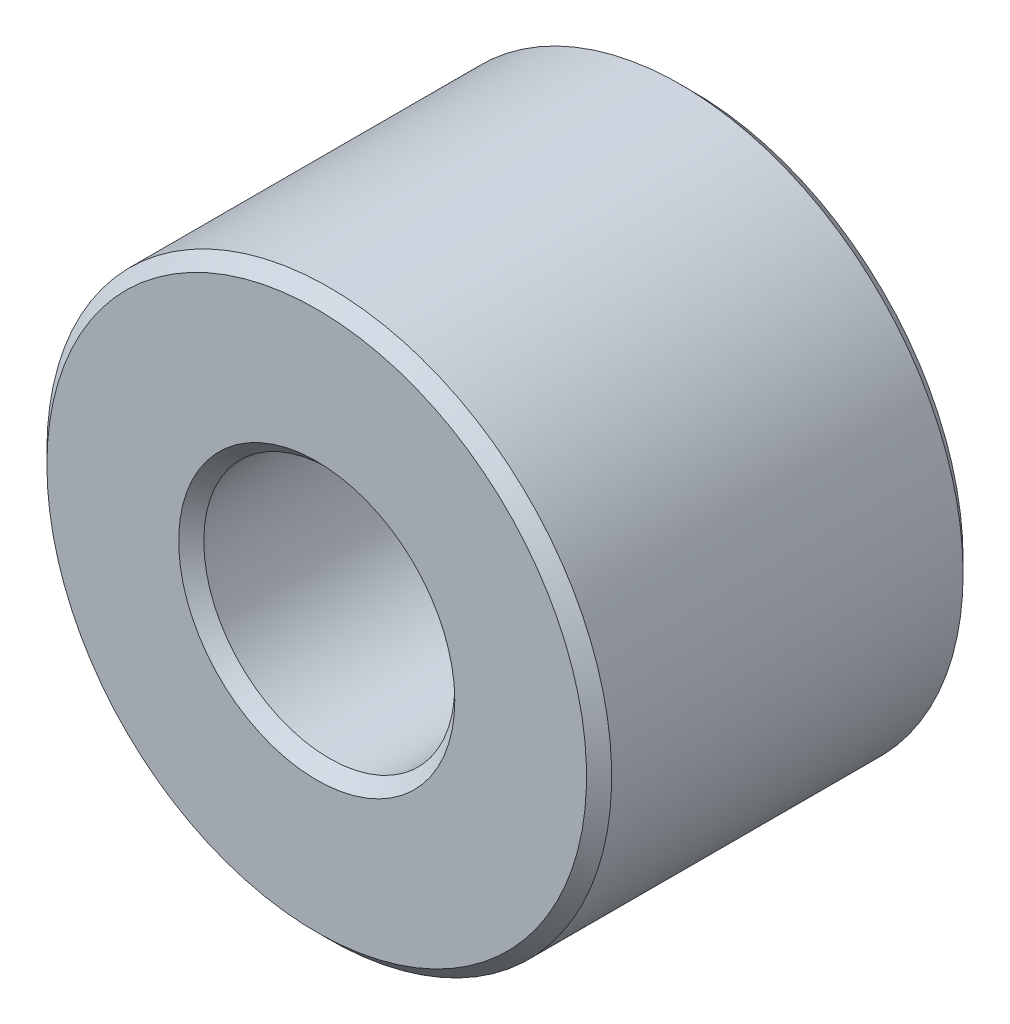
SolidWorks part; units mm, degrees
ref_plane "Front Plane" through (0, 0, 0) normal (0, 0, 1) x (1, 0, 0)
ref_plane "Top Plane" through (0, 0, 0) normal (0, 1, 0) x (1, 0, 0)
ref_plane "Right Plane" through (0, 0, 0) normal (1, 0, 0) x (0, 0, -1)
sketch "Sketch1" plane through (0, 0, 0) normal (0, 0, 1) x (1, 0, 0)
  circle A0 centre (0, 0) radius 8
  circle A1 centre (0, 0) radius 18
  dimension "D1" = 16
  dimension "D2" = 36
extrude "Boss-Extrude1" add sketch "Sketch1" along normal mid plane 24
chamfer "Chamfer1" distance 0.8 angle 45 4 edges at (8, 0, -12) (18, 0, -12) (8, 0, 12) (18, 0, 12)
